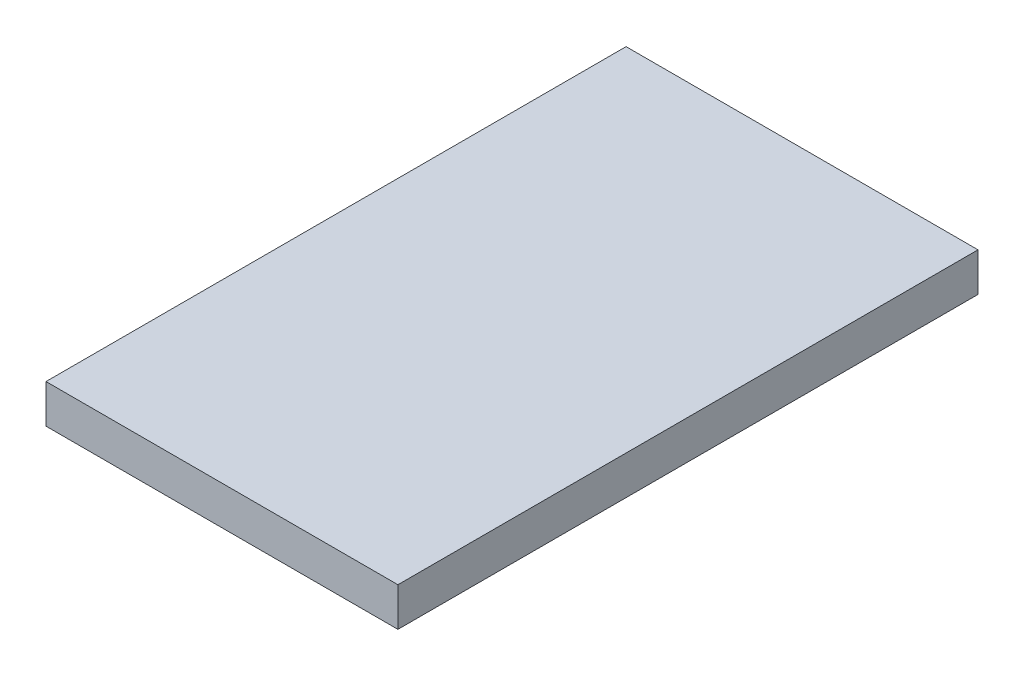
SolidWorks part; units mm, degrees
ref_plane "Front Plane" through (0, 0, 0) normal (0, 0, 1) x (1, 0, 0)
ref_plane "Top Plane" through (0, 0, 0) normal (0, 1, 0) x (1, 0, 0)
ref_plane "Right Plane" through (0, 0, 0) normal (1, 0, 0) x (0, 0, -1)
sketch "Sketch1" plane through (0, 0, 0) normal (0, 0, 1) x (1, 0, 0)
  line L1 (-45.5, 10) -> (45.5, 10)
  line L2 (-45.5, 10) -> (-45.5, 0)
  line L3 (-45.5, 0) -> (45.5, 0)
  line L4 (45.5, 10) -> (45.5, 0)
  dimension "D1" = 10
  dimension "D2" = 91
extrude "Extrude1" add sketch "Sketch1" along normal blind 150
